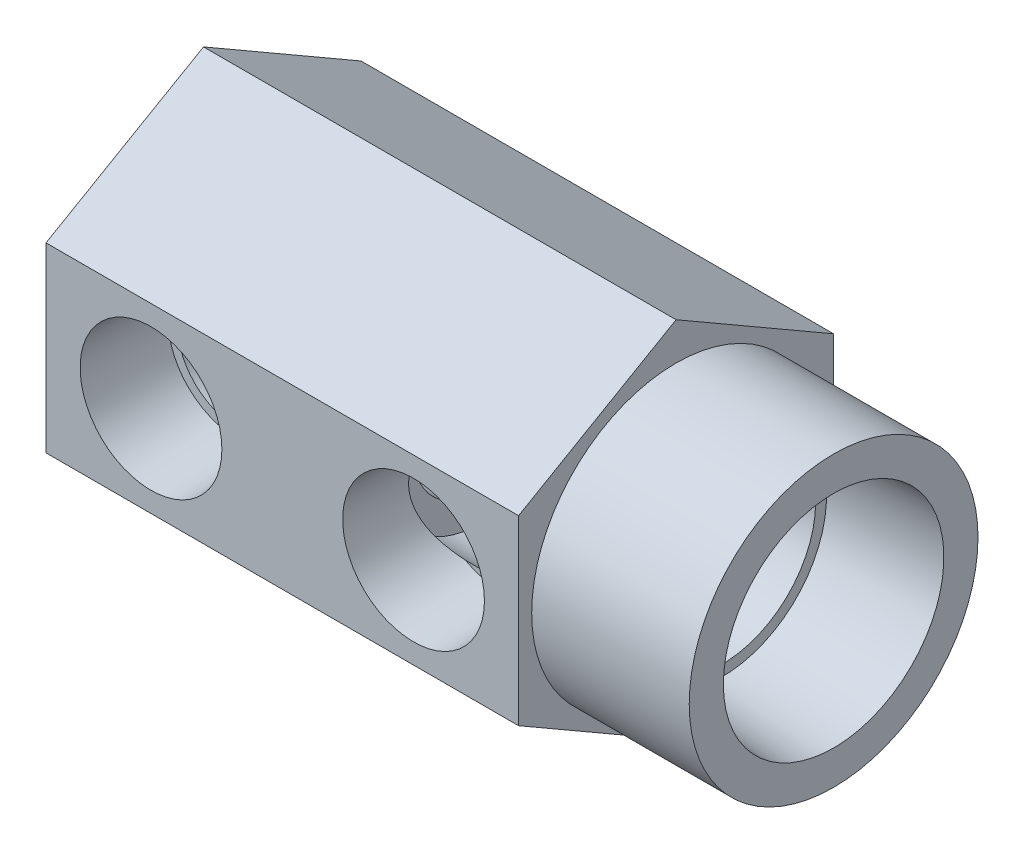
SolidWorks part; units mm, degrees
ref_plane "Front Plane" through (0, 0, 0) normal (0, 0, 1) x (1, 0, 0)
ref_plane "Top Plane" through (0, 0, 0) normal (0, 1, 0) x (1, 0, 0)
ref_plane "Right Plane" through (0, 0, 0) normal (1, 0, 0) x (0, 0, -1)
sketch "Sketch1" plane through (0, 0, 0) normal (1, 0, 0) x (0, 0, -1)
  line L0 (0, 24.1967) -> (0, -24.1967) construction
  line L1 (-19.05, -10.9985) -> (0, -21.997)
  line L2 (0, -21.997) -> (19.05, -10.9985)
  line L3 (19.05, -10.9985) -> (19.05, 10.9985)
  line L4 (19.05, 10.9985) -> (0, 21.997)
  line L5 (0, 21.997) -> (-19.05, 10.9985)
  line L6 (-19.05, 10.9985) -> (-19.05, -10.9985)
  circle A0 centre (0, 0) radius 19.05 construction
  dimension "D1" = 38.1
extrude "Boss-Extrude1" add sketch "Sketch1" along normal blind 57.15 separate body
sketch "Sketch3" plane through (0, 0, 0) normal (-1, 0, 0) x (0, 0, 1)
  circle A0 centre (0, 0) radius 17.4625
  dimension "D1" = 34.925
extrude "Boss-Extrude2" add sketch "Sketch3" against normal blind 76.2
sketch "Sketch4" plane through (0, 0, 0) normal (0, 0, 1) x (1, 0, 0)
  line L3 (62.7126, 11.3157) -> (33.3375, 11.3157)
  line L4 (62.7126, 11.3157) -> (62.7126, 12.6282)
  line L5 (76.2, 13.335) -> (62.7126, 12.6282)
  line L6 (76.2, -17.4625) -> (76.2, 17.4625) construction
  line L7 (76.2, 0) -> (76.2, 13.335)
  line L8 (0, 0) -> (50000, 0) construction
  line L9 (33.3375, 0) -> (33.3375, 11.3157)
  line L10 (33.3375, 0) -> (76.2, 0)
  dimension "D1" = 42.8625
  dimension "D2" = 22.6314
  dimension "D3" = 13.4874
  dimension "D4" = 26.67
  dimension "D5" = 3
revolve "Cut-Revolve1" cut sketch "Sketch4" angle 360 about L8
hole_wizard "3/8 NPT Tapped Hole2" positions "Sketch8" profile "Sketch7" size "3/8" standard "Ansi Inch"
sketch "Sketch8" plane through (0, 0, 19.05) normal (0, 0, 1) x (1, 0, 0)
  line L0 (20.955, 0) -> (-20.955, 0) construction
  line L1 (0, -20.955) -> (0, 20.955) construction
  point P0 (12.7, 0)
  point P1 (44.45, 0)
  dimension "D1" = 12.7
  dimension "D2" = 31.75
sketch "Sketch7" plane through (12.7, 0, 19.05) normal (1, 0, 0) x (0, -1, 0)
  line L0 (0, 0) -> (0, 21.6673)
  line L1 (7.1374, 17.3787) -> (0, 21.6673)
  line L2 (-7.1374, 17.3787) -> (0, 21.6673) construction
  line L3 (7.1374, 17.3787) -> (7.1374, 10.3302)
  line L4 (7.1374, 10.3302) -> (8.2632, 10.3302)
  line L5 (8.2632, 10.3302) -> (8.5725, 0)
  line L6 (-8.2632, 10.3302) -> (-8.5725, 0) construction
  line L7 (8.5725, 0) -> (0, 0)
  line L8 (0, -6.35) -> (0, 107.95) construction
  line L11 (-7.1374, 10.3302) -> (-8.2632, 10.3302) construction
  dimension "Tap Drill Dia." = 14.2748
  dimension "Tap Drill Depth" = 17.3787
  dimension "Thread Dia." = 17.145
  dimension "Thread Angle" = 3.43
  dimension "Thread Depth" = 10.3302
  dimension "Drill Angle" = 118
hole_wizard "3/8 NPT Tapped Hole3" positions "Sketch10" profile "Sketch9" size "3/8" standard "Ansi Inch"
sketch "Sketch10" plane through (0, 0, -19.05) normal (0, 0, -1) x (-1, 0, 0)
  circle A0 centre (-12.7, 0) radius 8.5725 construction
  point P0 (-12.7, 0)
sketch "Sketch9" plane through (12.7, 0, -19.05) normal (1, 0, 0) x (0, 1, 0)
  line L0 (0, 0) -> (0, 26.5136)
  line L1 (7.1374, 22.225) -> (0, 26.5136)
  line L2 (-7.1374, 22.225) -> (0, 26.5136) construction
  line L3 (7.1374, 22.225) -> (7.1374, 10.3302)
  line L4 (7.1374, 10.3302) -> (8.2632, 10.3302)
  line L5 (8.2632, 10.3302) -> (8.5725, 0)
  line L6 (-8.2632, 10.3302) -> (-8.5725, 0) construction
  line L7 (8.5725, 0) -> (0, 0)
  line L8 (0, -6.35) -> (0, 107.95) construction
  line L11 (-7.1374, 10.3302) -> (-8.2632, 10.3302) construction
  dimension "Tap Drill Dia." = 14.2748
  dimension "Tap Drill Depth" = 22.225
  dimension "Thread Dia." = 17.145
  dimension "Thread Angle" = 3.43
  dimension "Thread Depth" = 10.3302
  dimension "Drill Angle" = 118
hole_wizard "37/64 (0.57813) Diameter Hole1" positions "Sketch12" profile "Sketch11" hole size "37/64" standard "Ansi Inch"
sketch "Sketch12" plane through (76.2, 0, 0) normal (1, 0, 0) x (0, 0, -1)
  circle A0 centre (0, 0) radius 13.335 construction
  point P0 (0, 0)
sketch "Sketch11" plane through (76.2, 0, 0) normal (0, 1, 0) x (0, 0, -1)
  line L0 (0, 0) -> (0, 67.9117)
  line L1 (0, 67.9117) -> (7.3423, 63.5)
  line L2 (7.3423, 63.5) -> (7.3423, 0)
  line L5 (7.3423, 0) -> (0, 0)
  line L10 (0, 67.9117) -> (-7.3423, 63.5) construction
  line L11 (0, -6.35) -> (0, 107.95) construction
  dimension "Hole Dia." = 14.6845
  dimension "Hole Depth" = 63.5
  dimension "Drill Angle" = 118
hole_wizard "5/8 (0.625) Diameter Hole1" positions "Sketch14" profile "Sketch13" hole size "5/8" standard "Ansi Inch"
sketch "Sketch14" plane through (76.2, 0, 0) normal (1, 0, 0) x (0, 0, -1)
  circle A0 centre (0, 0) radius 17.4625 construction
  point P0 (0, 0)
sketch "Sketch13" plane through (76.2, 0, 0) normal (0, 1, 0) x (0, 0, -1)
  line L0 (0, 0) -> (0, 53.9818)
  line L1 (0, 53.9818) -> (7.9375, 49.2125)
  line L2 (7.9375, 49.2125) -> (7.9375, 0)
  line L5 (7.9375, 0) -> (0, 0)
  line L10 (0, 53.9818) -> (-7.9375, 49.2125) construction
  line L11 (0, -6.35) -> (0, 107.95) construction
  dimension "Hole Dia." = 15.875
  dimension "Hole Depth" = 49.2125
  dimension "Drill Angle" = 118
